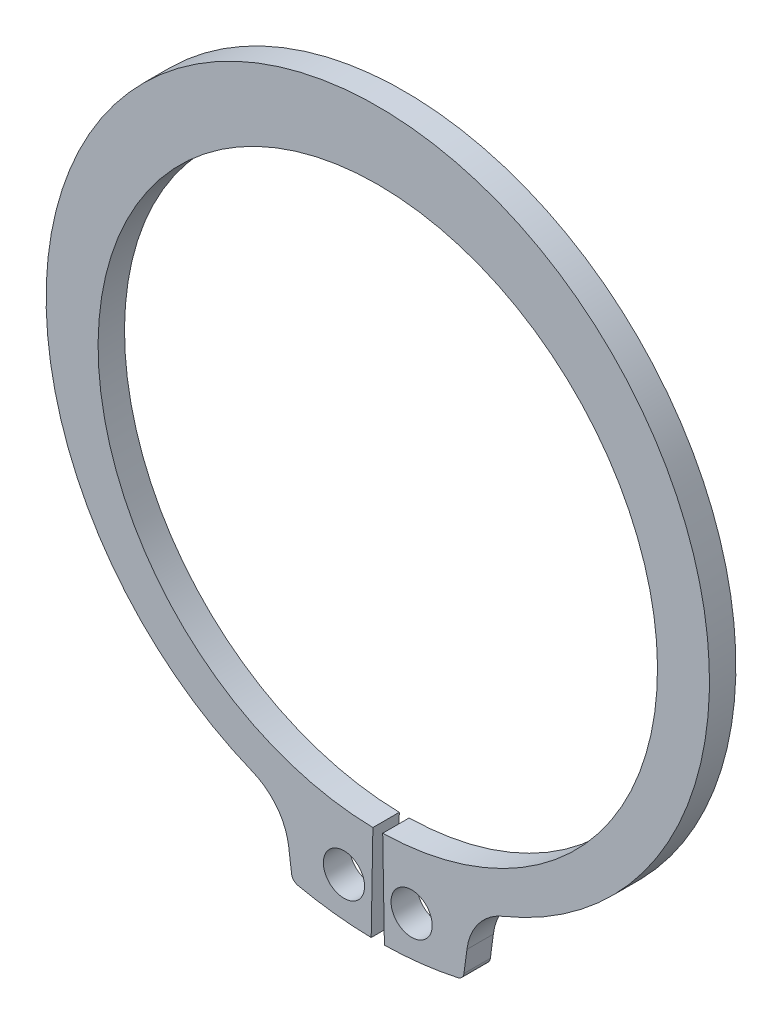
SolidWorks part; units mm, degrees
ref_plane "Plane1" through (0, 0, 0) normal (0, 0, 1) x (1, 0, 0)
ref_plane "Plane2" through (0, 0, 0) normal (0, 1, 0) x (1, 0, 0)
ref_plane "Plane3" through (0, 0, 0) normal (1, 0, 0) x (0, 0, -1)
sketch "Clipboard" plane through (0, 0, 0) normal (0, 0, 1) x (1, 0, 0)
  line L0 (0, 0) -> (3.2512, 0)
  line L1 (0, 0) -> (0, 1.8034)
  line L2 (0, 0) -> (0, -4.6228)
  circle A0 centre (0, 0) radius 0.9906
  circle A1 centre (0, 0) radius 14.2875
  dimension "HoleDia" = 1.9812
  dimension "ShaftDia" = 28.575
  dimension "LargeSection" = 3.2512
  dimension "SmallSection" = 1.8034
  dimension "LugSection" = 4.6228
sketch "BodySke" plane through (0, 0, 0) normal (0, 0, 1) x (1, 0, 0)
  line L0 (-1.5431, 0) -> (1.5431, 0) construction
  line L1 (0, 0) -> (0, 16.7005) construction
  line L2 (0.2363, -13.4472) -> (0.3175, -18.0693)
  line L3 (-0.2363, -13.4472) -> (-0.3175, -18.0693)
  line L4 (0, 0) -> (7.0802, -16.6274) construction
  line L5 (0, 0) -> (-7.0802, -16.6274) construction
  line L7 (4.2854, -16.2595) -> (4.1437, -17.3353)
  line L8 (-4.2854, -16.2595) -> (-4.1437, -17.3353)
  circle A0 centre (0, 0) radius 13.4493 construction
  arc A1 (0.2363, -13.4472) -> (-0.2363, -13.4472) centre (0, 0) ccw
  arc A2 (5.9757, -14.0334) -> (-5.9757, -14.0334) centre (0, 0.7526) ccw construction
  arc A3 (0.3175, -18.0693) -> (3.8471, -17.6579) centre (0, 0) ccw
  arc A4 (6.0167, -14.0167) -> (4.2854, -16.2595) centre (7.0802, -16.6274) ccw
  arc A5 (-4.2854, -16.2595) -> (-6.0167, -14.0167) centre (-7.0802, -16.6274) ccw
  arc A6 (-3.8471, -17.6579) -> (-0.3175, -18.0693) centre (0, 0) ccw
  arc A7 (6.0167, -14.0167) -> (-6.0167, -14.0167) centre (0, 0.7526) ccw
  arc A8 (-4.3752, -15.577) -> (4.3752, -15.577) centre (0, 0) ccw construction
  circle A9 centre (1.6256, -16.0979) radius 0.9906
  circle A10 centre (-1.6256, -16.0979) radius 0.9906
  arc A11 (4.1437, -17.3353) -> (3.8471, -17.6579) centre (3.766, -17.2856) cw
  arc A12 (-4.1437, -17.3353) -> (-3.8471, -17.6579) centre (-3.766, -17.2856) ccw
  point P28 (4.1091, -17.5988)
  point P31 (-4.1091, -17.5988)
  dimension "GrooveDia" = 26.8986
  dimension "D3" = 0.381
  dimension "LugRad" = 18.0721
  dimension "HoleOffsetRad" = 16.1798
  dimension "HoleDia" = 1.9812
  dimension "D2" = 15
  dimension "LargeRad" = 16.7005
  dimension "SmallRad" = 15.2527
  dimension "Gap" = 0.635
  dimension "SmallAngle" = 46.13
  dimension "HoleSpacing" = 3.2512
extrude "Body" add sketch "BodySke" against normal blind 1.27
sketch "NotSke" plane through (0, 0, 0) normal (0, 0, 1) x (1, 0, 0)
  line L0 (1.6256, -15.1073) -> (1.6256, -17.0885)
  line L1 (1.6256, -17.0885) -> (-1.6256, -17.0885)
  line L2 (-1.6256, -17.0885) -> (-1.6256, -15.1073)
  line L3 (-1.6256, -15.1073) -> (1.6256, -15.1073)
  circle A0 centre (1.6256, -16.0979) radius 0.9906 construction
  circle A1 centre (-1.6256, -16.0979) radius 0.9906 construction
extrude "Notch" [suppressed] cut sketch "NotSke" against normal through all
equation "' \"ShaftDia@Clipboard\" = 0.125"
equation "' \"Thickness@Body\" = 0.01"
equation "' \"GrooveDia@BodySke\" = 0.117"
equation "' \"LugSection@Clipboard\" = 0.046"
equation "' \"LargeSection@Clipboard\" = 0.018"
equation "' \"SmallSection@Clipboard\" = 0.011"
equation "' \"HoleDia@Clipboard\" = 0.026"
equation "' \"ShaftDia@Clipboard\" = 0.394"
equation "' \"Thickness@Body\" = 0.025"
equation "' \"GrooveDia@BodySke\" = 0.369"
equation "' \"LugSection@Clipboard\" = 0.087"
equation "' \"LargeSection@Clipboard\" = 0.052"
equation "' \"SmallSection@Clipboard\" = 0.031"
equation "' \"HoleDia@Clipboard\" = 0.041"
equation "\"Gap@BodySke\" =  \"Thickness@Body\" / 2"
equation "\"LargeRad@BodySke\" =  \"GrooveDia@BodySke\" / 2 +  \"LargeSection@Clipboard\""
equation "\"SmallRad@BodySke\" =  \"GrooveDia@BodySke\" / 2 +  \"SmallSection@Clipboard\""
equation "\"LugRad@BodySke\" = \"GrooveDia@BodySke\" / 2 + \"LugSection@Clipboard\""
equation "\"HoleOffsetRad@BodySke\" = (  \"ShaftDia@Clipboard\" / 2 + \"LugRad@BodySke\" ) / 2"
equation "\"HoleSpacing@BodySke\" = \"Gap@BodySke\"  * 2 +  \"HoleDia@Clipboard\""
equation "\"HoleDia@BodySke\" =  \"HoleDia@Clipboard\""
equation "\"SmallAngle@BodySke\" = atn(\"HoleSpacing@BodySke\" / 2 / sqr(\"HoleOffsetRad@BodySke\"  * \"HoleOffsetRad@BodySke\" - (\"HoleSpacing@BodySke\" / 2) * (\"HoleSpacing@BodySke\" / 2) ))  * 8 * ( 180 / 3.141593)"
